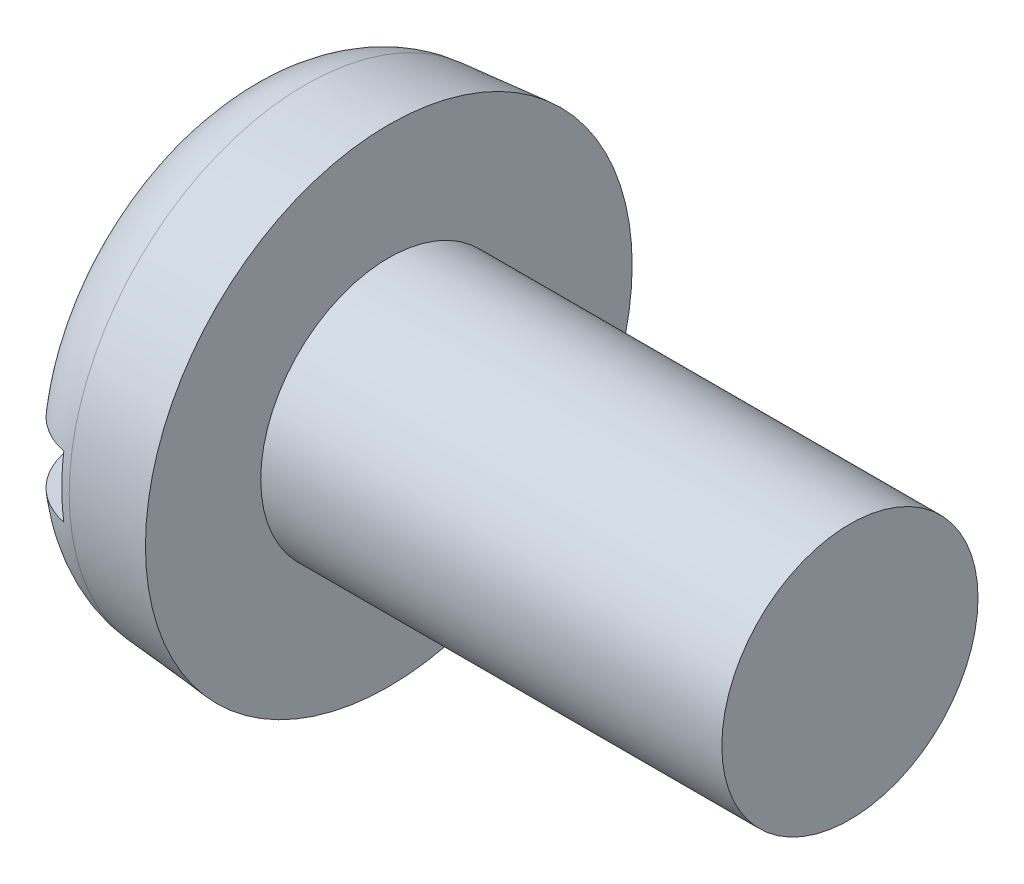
SolidWorks part; units mm, degrees
ref_plane "Plane1" through (0, 0, 0) normal (0, 0, 1) x (1, 0, 0)
ref_plane "Plane2" through (0, 0, 0) normal (0, 1, 0) x (1, 0, 0)
ref_plane "Plane3" through (0, 0, 0) normal (1, 0, 0) x (0, 0, -1)
sketch "BodySke" plane through (0, 0, 0) normal (0, 0, 1) x (1, 0, 0)
  line L0 (3, 2.5) -> (3, 4.75)
  line L1 (0, 0) -> (0, 4.4875)
  line L2 (-25.4, 0) -> (127, 0) construction
  line L3 (12, 0) -> (0, 0)
  line L4 (3, 2.5) -> (12, 2.5)
  line L5 (12, 2.5) -> (12, 0)
  line L6 (0, 4.4875) -> (3, 4.75)
  line L9 (3.8, 4.0875) -> (3.8, -5.4375) construction
  line L10 (3, 6.35) -> (3, -3.175) construction
  dimension "Head_ht" = 3
  dimension "Diameter" = 5
  dimension "Length" = 9
  dimension "Head_dia" = 9.5
  dimension "Advance" = 0.8
  dimension "Thread_nom" = 9
  dimension "Head_side_angle" = 5
revolve "Base-Revolve" add sketch "BodySke"
fillet "Fillet1" [suppressed] radius 0.2
fillet "Fillet2" radius 1.5 1 edges at (0, 0, 4.4875)
sketch "Sketch2" plane through (0, 0, 0) normal (1, 0, 0) x (0, 0, -1)
  line L0 (4.75, -0.6) -> (-4.75, -0.6)
  line L1 (4.75, -0.6) -> (4.75, 0.6)
  line L2 (-4.75, 0.6) -> (4.75, 0.6)
  line L3 (-4.75, 0.6) -> (-4.75, -0.6)
  dimension "D1" = 9.5
  dimension "D2" = 4.75
  dimension "Slot_width" = 1.2
  dimension "D3" = 0.6
extrude "Slot" cut sketch "Sketch2" along normal blind 1.2
sketch "ThdSchSke" plane through (0, 0, 0) normal (0, 0, 1) x (1, 0, 0)
  line L0 (4.6, -2.055) -> (4.2884, -2.5)
  line L1 (4.6, -2.055) -> (4.9116, -2.5)
  line L2 (4.9116, -2.5) -> (4.9116, -3.125)
  line L3 (-3.175, 0) -> (5.1513, 0) construction
  line L5 (4.9116, -3.125) -> (4.2884, -3.125)
  line L6 (4.2884, -3.125) -> (4.2884, -2.5)
  dimension "Thread_minor" = 4.11
  dimension "Diameter" = 5
  dimension "Start" = 4.6
  dimension "SideAngle" = 55
  dimension "VeeAngle" = 70
  dimension "Overcut" = 6.25
revolve "ThreadSchematic" [suppressed] cut sketch "ThdSchSke" angle 360 about L3
pattern_linear "ThdSchPat" [suppressed]
equation "\"D1@Sketch2\" = \"Head_dia@BodySke\""
equation "\"D2@Sketch2\" = \"D1@Sketch2\" / 2"
equation "\"D3@Sketch2\" = \"Slot_width@Sketch2\" / 2"
equation "\"Thread_length@ThreadCosmetic\" = ((sgn( (\"Length@BodySke\" - \"Advance@BodySke\" * 2.0 ) - \"Thread_nom@BodySke\" )-1)*( (\"Length@BodySke\" - \"Advance@BodySke\"  * 2.0) - \"Thread_nom@BodySke\" ))/-2+ \"Thread_"
equation "\"Thread_minor@ThdSchSke\" = \"Thread_minor@ThreadCosmetic\""
equation "\"Diameter@ThdSchSke\" = \"Diameter@BodySke\""
equation "\"Overcut@ThdSchSke\" = \"Diameter@BodySke\" * 1.25"
equation "\"Start@ThdSchSke\" = \"Head_ht@BodySke\" + \"Length@BodySke\" - \"Thread_length@ThreadCosmetic\"  '---Non-countersunk---"
equation "\"Num_threads@ThdSchPat\" = int( \"Thread_length@ThreadCosmetic\" / \"Advance@BodySke\" + 0.999 )  + 1"
equation "\"Advance@ThdSchPat\" = \"Thread_length@ThreadCosmetic\" /  (\"Num_threads@ThdSchPat\" - 1) 'relax it"
